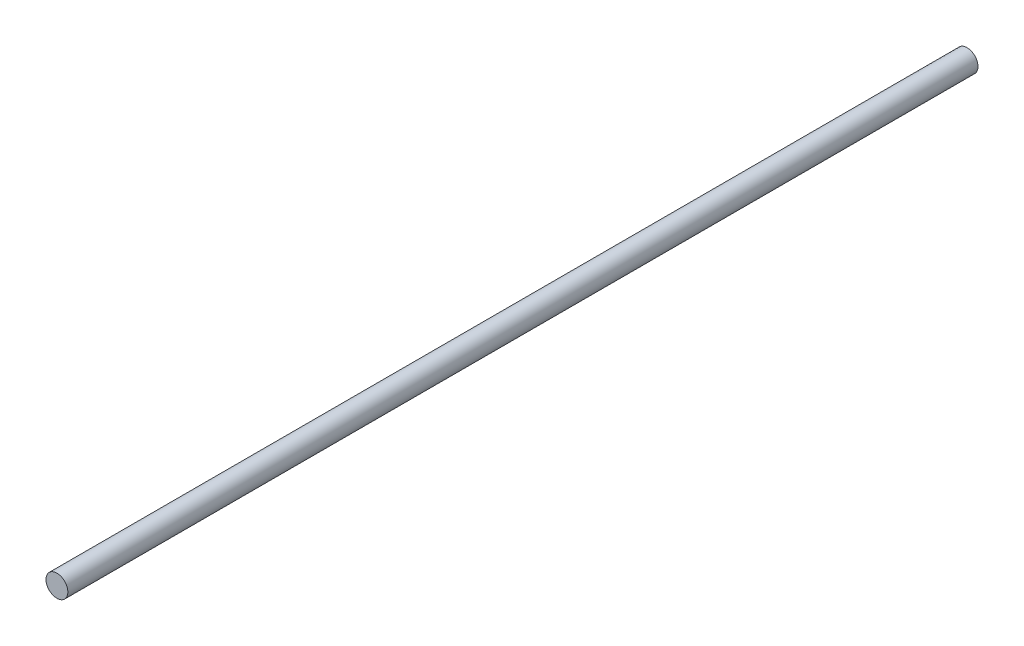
SolidWorks part; units mm, degrees
ref_plane "前视基准面" through (0, 0, 0) normal (0, 0, 1) x (1, 0, 0)
ref_plane "上视基准面" through (0, 0, 0) normal (0, 1, 0) x (1, 0, 0)
ref_plane "右视基准面" through (0, 0, 0) normal (1, 0, 0) x (0, 0, -1)
sketch "草图1" plane through (0, 0, 0) normal (0, 0, 1) x (1, 0, 0)
  circle A0 centre (-1.2942, 0) radius 6
  dimension "D1" = 12
extrude "凸台-拉伸1" add sketch "草图1" along normal blind 500
